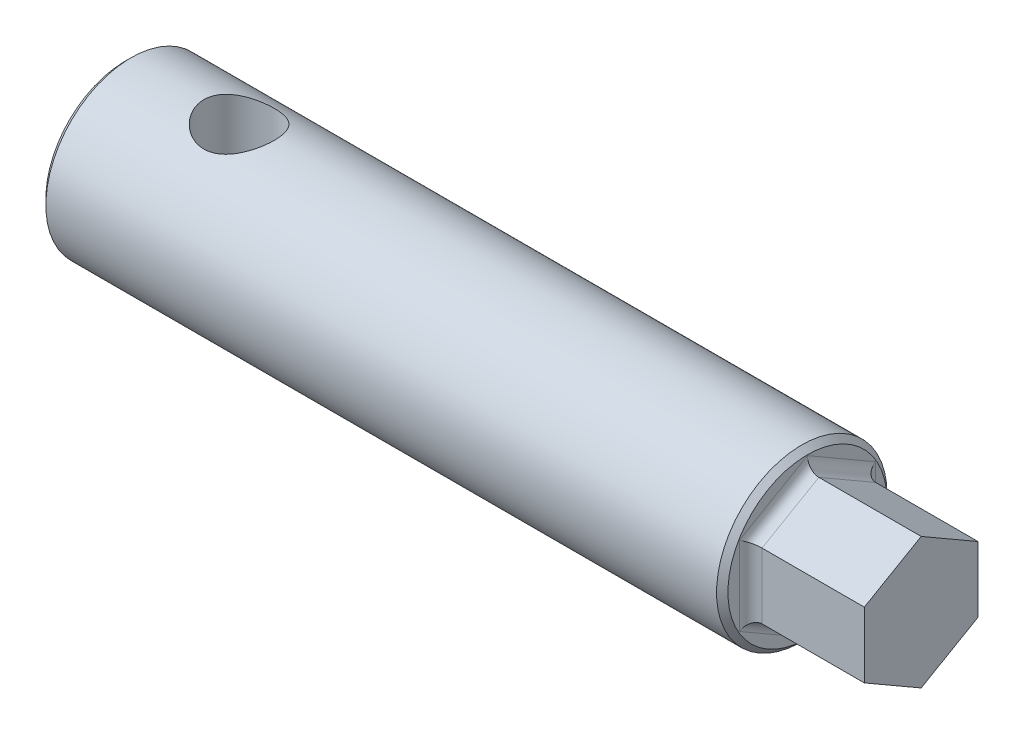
SolidWorks part; units mm, degrees
ref_plane "Ebene vorne" through (0, 0, 0) normal (0, 0, 1) x (1, 0, 0)
ref_plane "Ebene oben" through (0, 0, 0) normal (0, 1, 0) x (1, 0, 0)
ref_plane "Ebene rechts" through (0, 0, 0) normal (1, 0, 0) x (0, 0, -1)
sketch "Skizze1" plane through (0, 0, 0) normal (1, 0, 0) x (0, 0, -1)
  circle A0 centre (0, 0) radius 7.5
  dimension "D1" = 15
extrude "Aufsatz-Linear austragen1" add sketch "Skizze1" along normal blind 60
sketch "Skizze2" plane through (0, 0, 0) normal (0, 0, 1) x (1, 0, 0)
  line L0 (60, 7.5) -> (0, 7.5) construction
  line L1 (0, 7.5) -> (0, -7.5) construction
  point P0 (10, 7.5)
  dimension "D1" = 10
hole_wizard "Ø6.2 (6.2) Durchmesser Bohrung1" positions "3D-Skizze1" profile "Skizze3" hole size "Ø6.2" standard "DIN"
sketch3d "3D-Skizze1"
  point P0 (10, 7.5, 0)
sketch "Skizze3" plane through (10, 7.5, 0) normal (1, 0, 0) x (0, 0, 1)
  line L0 (0, 0) -> (0, 15)
  line L1 (0, 15) -> (3.1, 15)
  line L2 (3.1, 15) -> (3.1, 0)
  line L5 (3.1, 0) -> (0, 0)
  line L11 (0, -6.35) -> (0, 107.95) construction
  dimension "Bohrerdurchmesser" = 6.2
  dimension "Bohrungstiefe" = 15
sketch "Skizze4" plane through (60, 0, 0) normal (1, 0, 0) x (0, 0, -1)
  line L1 (0, 5.7735) -> (-5, 2.8868)
  line L2 (-5, 2.8868) -> (-5, -2.8868)
  line L3 (-5, -2.8868) -> (0, -5.7735)
  line L4 (0, -5.7735) -> (5, -2.8868)
  line L5 (5, -2.8868) -> (5, 2.8868)
  line L6 (5, 2.8868) -> (0, 5.7735)
  circle A0 centre (0, 0) radius 5 construction
  dimension "D1" = 10
extrude "Aufsatz-Linear austragen2" add sketch "Skizze4" along normal blind 10
fillet "Verrundung1" radius 1 6 edges at (60, 0, 5) (60, -4.3301, 2.5) (60, -4.3301, -2.5) (60, 0, -5) (60, 4.3301, -2.5) (60, 4.3301, 2.5)
chamfer "Fase1" distance 0.5 angle 45 2 edges at (60, 0, -7.5) (0, 0, -7.5)
hole_wizard "M6 Gewindebohrung1" positions "3D-Skizze2" profile "Skizze5" tap size "M6" standard "DIN"
sketch3d "3D-Skizze2"
  point P0 (10, 7.5, 0)
sketch "Skizze5" plane through (10, 7.5, 0) normal (1, 0, 0) x (0, 0, 1)
  line L0 (0, 0) -> (0, 15)
  line L1 (0, 15) -> (2.5, 15)
  line L2 (2.5, 15) -> (2.5, 0)
  line L5 (2.5, 0) -> (0, 0)
  line L11 (0, -6.35) -> (0, 107.95) construction
  dimension "Bohrerdurchmesser" = 5
  dimension "Bohrungstiefe" = 15
